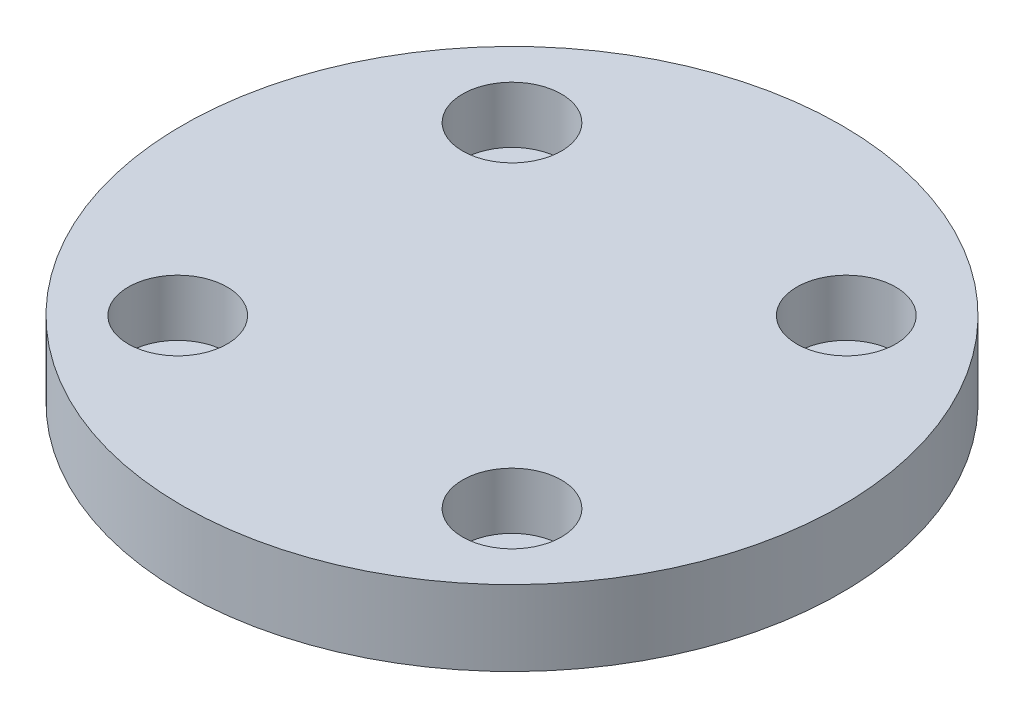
SolidWorks part; units mm, degrees
ref_plane "Front Plane" through (0, 0, 0) normal (0, 0, 1) x (1, 0, 0)
ref_plane "Top Plane" through (0, 0, 0) normal (0, 1, 0) x (1, 0, 0)
ref_plane "Right Plane" through (0, 0, 0) normal (1, 0, 0) x (0, 0, -1)
sketch "Sketch1" plane through (0, 0, 0) normal (0, 1, 0) x (1, 0, 0)
  circle A0 centre (0, 0) radius 35
  dimension "D1" = 70
extrude "Boss-Extrude1" add sketch "Sketch1" along normal blind 8
sketch "Sketch2" plane through (0, 8, 0) normal (0, 1, 0) x (1, 0, 0)
  circle A0 centre (-17.75, 17.75) radius 5.25
  circle A1 centre (17.75, 17.75) radius 5.25
  circle A2 centre (17.75, -17.75) radius 5.25
  circle A3 centre (-17.75, -17.75) radius 5.25
extrude "Cut-Extrude1" cut sketch "Sketch2" against normal blind 6
sketch "Sketch3" plane through (0, 2, 0) normal (0, 1, 0) x (1, 0, 0)
  circle A0 centre (17.75, 17.75) radius 3.25
  circle A1 centre (-17.75, 17.75) radius 3.25
  circle A2 centre (-17.75, -17.75) radius 3.25
  circle A3 centre (17.75, -17.75) radius 3.25
  dimension "D1" = 6.5
extrude "Cut-Extrude2" cut sketch "Sketch3" against normal blind 2
equation "\"D5@Sketch2\"=\"D4@Sketch2\"/2"
equation "\"D9@Sketch2\"=\"D8@Sketch2\"/2"
equation "\"D3@Sketch2\"=\"D2@Sketch2\"/2"
equation "\"D7@Sketch2\"=\"D6@Sketch2\"/2"
